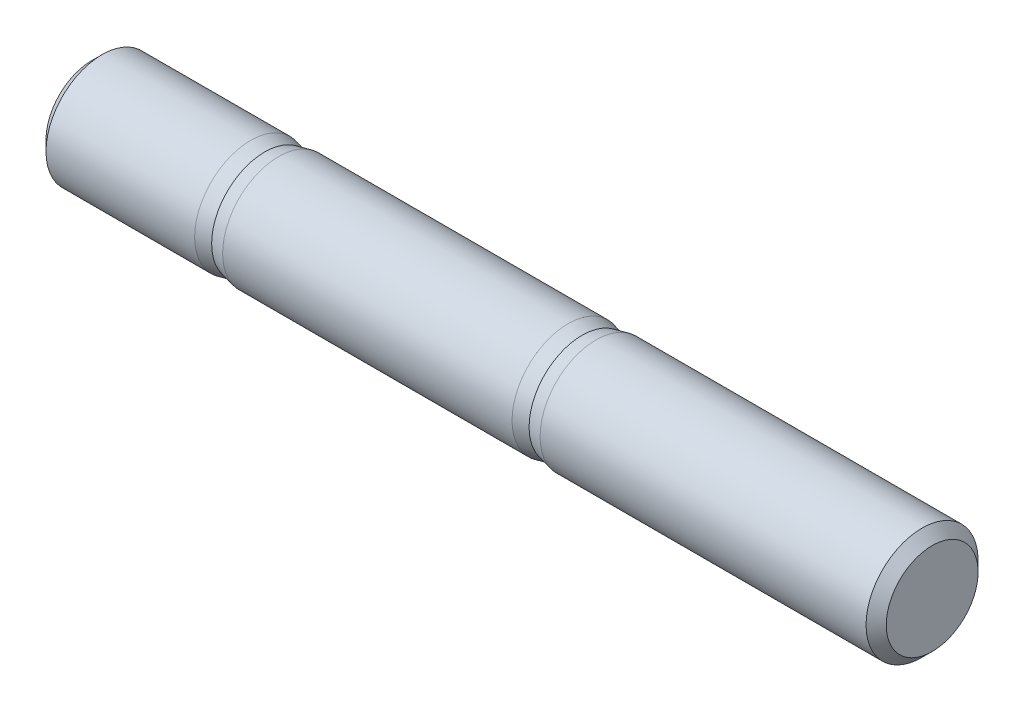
SolidWorks part; units mm, degrees
ref_plane "Front" through (0, 0, 0) normal (0, 0, 1) x (1, 0, 0)
ref_plane "Top" through (0, 0, 0) normal (0, 1, 0) x (1, 0, 0)
ref_plane "Right" through (0, 0, 0) normal (1, 0, 0) x (0, 0, -1)
sketch "Sketch1" plane through (0, 0, 0) normal (0, 0, 1) x (1, 0, 0)
  line L0 (-1.3108, 0) -> (30.3862, 0) construction
  line L1 (0, 0) -> (0, 3)
  line L2 (0, 3) -> (8.5, 3)
  line L3 (8.5, 3) -> (10, 2.675)
  line L4 (10, 2.675) -> (25.5, 2.675)
  line L5 (25.5, 2.675) -> (27, 3)
  line L6 (27, 3) -> (45, 3)
  line L7 (45, 3) -> (45, 0)
  line L8 (45, 0) -> (0, 0)
  dimension "X" = 1.5
  dimension "D2" = 1.5
  dimension "bm" = 10
  dimension "b" = 18
  dimension "l" = 35
  dimension "d" = 6
  dimension "ds" = 5.35
revolve "BaseHead" add sketch "Sketch1" angle 360 about L0
chamfer "HeadChamfer" distance 0.5415 angle 45 2 edges at (0, 0, 3) (45, 0, 3)
sketch "Sketch2" plane through (0, 0, 0) normal (0, 0, 1) x (1, 0, 0)
  line L0 (-1.3108, 0) -> (31.2107, 0) construction
  line L2 (8.5, 2.675) -> (10, 3)
  line L3 (10, 3) -> (25.5, 3)
  line L4 (25.5, 3) -> (27, 2.675)
  line L7 (8.5, 3) -> (8.5, -3) construction
  line L9 (8.5, 2.675) -> (27, 2.675)
  line L10 (27, 3) -> (27, -3) construction
  dimension "D1" = 1.5
  dimension "D2" = 6
revolve "BaseBody" add sketch "Sketch2" angle 360 about L0
sketch "Sketch3" plane through (0, 0, 0) normal (0, 0, 1) x (1, 0, 0)
  line L0 (44.4585, 2.531) -> (44.7293, 3)
  line L1 (44.7293, 3) -> (44.7293, 3.5)
  line L2 (44.7293, 3.5) -> (44.1878, 3.5)
  line L3 (44.1878, 3.5) -> (44.1878, 3)
  line L4 (44.1878, 3) -> (44.4585, 2.531)
  line L5 (0, 0) -> (54.5942, 0) construction
  line L6 (44.4585, 3) -> (44.4585, -3) construction
  dimension "D1" = 60
  dimension "D2" = 60
  dimension "D3" = 0.5
  dimension "D4" = 0.5415
  dimension "D5" = 6
revolve "Cut-Revolve10" [suppressed] cut sketch "Sketch3" angle 360 about L5
pattern_linear "LPattern10" [suppressed] count 28 spacing 0.6498 along (1, 0, 0)
sketch "Sketch4" plane through (0, 0, 0) normal (0, 0, 1) x (1, 0, 0)
  line L0 (0.5415, 2.531) -> (0.8122, 3)
  line L1 (0.8122, 3) -> (0.8122, 3.5)
  line L2 (0.8122, 3.5) -> (0.2707, 3.5)
  line L3 (0.2707, 3.5) -> (0.2707, 3)
  line L4 (0.2707, 3) -> (0.5415, 2.531)
  line L5 (0, 0) -> (16.1581, 0) construction
  line L6 (0, 2.4585) -> (0, -2.4585) construction
  line L7 (0.5415, 3) -> (0.5415, -3) construction
  dimension "D1" = 60
  dimension "D2" = 60
  dimension "D3" = 0.5
  dimension "D4" = 0.5415
  dimension "D5" = 6
revolve "Cut-Revolve11" [suppressed] cut sketch "Sketch4" angle 360 about L5
pattern_linear "LPattern11" [suppressed] count 13 spacing 0.6498 along (1, 0, 0)
equation "\"D2@Sketch1\" = \"X@Sketch1\""
equation "\"D2@ThreadCosmetic2\" = \"D2@ThreadCosmetic1\""
equation "\"D1@ThreadCosmetic1\" = \"bm@Sketch1\"-\"X@Sketch1\""
equation "\"b@ThreadCosmetic2\" = \"b@Sketch1\""
equation "\"D1@Sketch2\" = \"X@Sketch1\""
equation "\"D2@Sketch2\" = \"d@Sketch1\""
equation "\"D1@HeadChamfer\" =  ( \"d@Sketch1\" - \"D2@ThreadCosmetic1\" )  / 2"
equation "\"D5@Sketch3\" = \"d@Sketch1\""
equation "\"D4@Sketch3\" = (  \"d@Sketch1\" - \"D2@ThreadCosmetic2\" )  / 2"
equation "\"D3@LPattern10\" = \"D4@Sketch3\" * 1.2"
equation "\"D1@LPattern10\" = \"b@ThreadCosmetic2\" / \"D3@LPattern10\""
equation "\"D5@Sketch4\" = \"d@Sketch1\""
equation "\"D4@Sketch4\" = (  \"d@Sketch1\" - \"D2@ThreadCosmetic1\" )  / 2"
equation "\"D3@LPattern11\" = \"D4@Sketch4\" * 1.2"
equation "\"D1@LPattern11\" = \"D1@ThreadCosmetic1\" / \"D3@LPattern11\""
